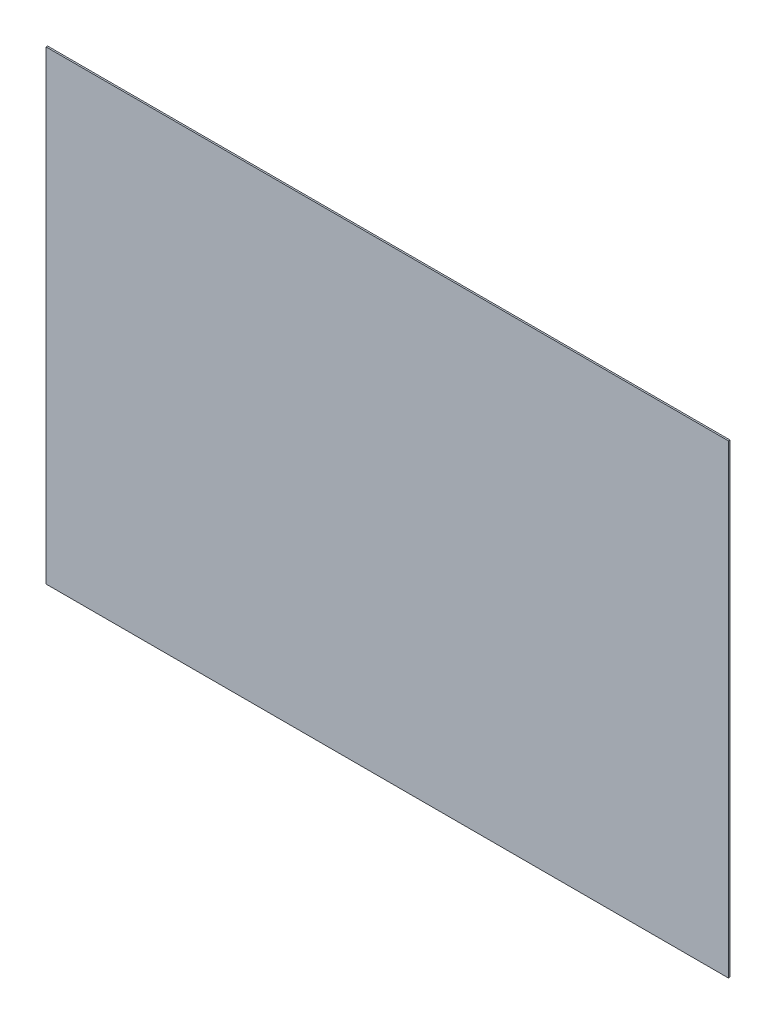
SolidWorks part; units mm, degrees
ref_plane "Plan1" through (0, 0, 0) normal (0, 0, 1) x (1, 0, 0)
ref_plane "Plan2" through (0, 0, 0) normal (0, 1, 0) x (1, 0, 0)
ref_plane "Plan3" through (0, 0, 0) normal (1, 0, 0) x (0, 0, -1)
sketch "Esquisse1" plane through (0, 0, 0) normal (0, 0, 1) x (1, 0, 0)
  line L0 (0, 69.4) -> (0, -69.4) construction
  line L1 (-1100, 750) -> (1100, 750)
  line L2 (-1100, 750) -> (-1100, -750)
  line L3 (-1100, -750) -> (1100, -750)
  line L4 (1100, 750) -> (1100, -750)
  line L5 (-133.3, 0) -> (133.3, 0) construction
  dimension "D1" = 2200
  dimension "D2" = 1500
extrude "Base-Extrusion" add sketch "Esquisse1" along normal blind 5
